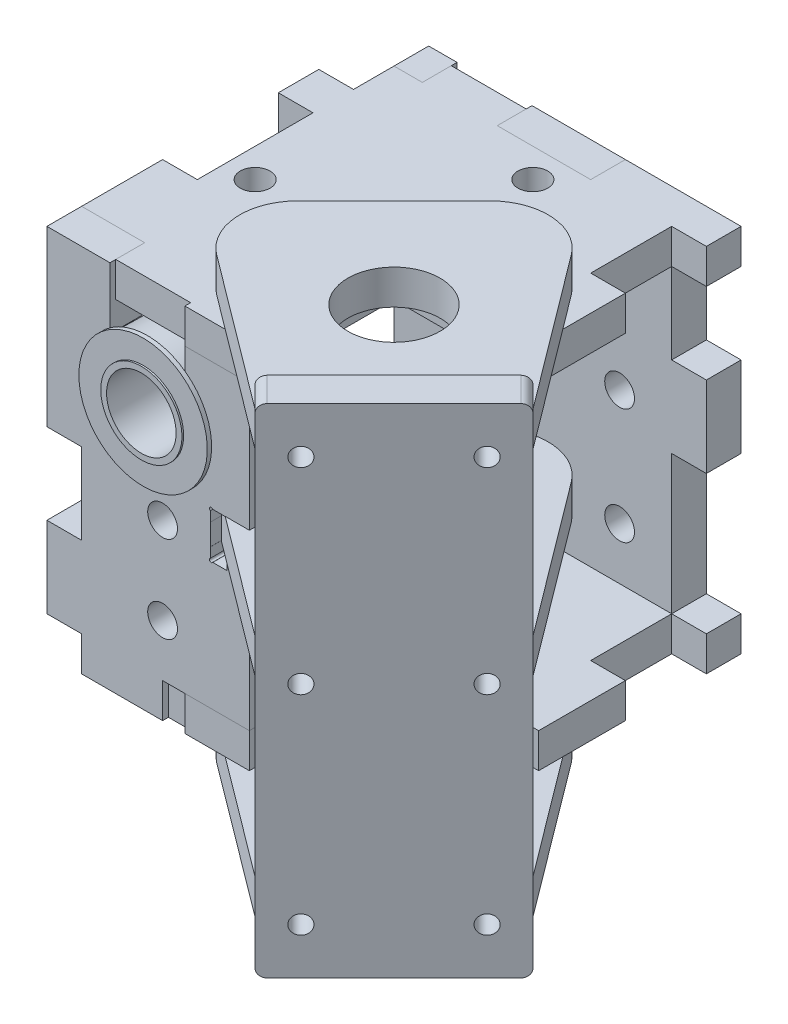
SolidWorks part; units mm, degrees
other "<linear bearing>-<Revolve1>" parameters "3mm insert"=5.15
ref_plane "Front" through (0, 0, 0) normal (0, 0, 1) x (1, 0, 0)
ref_plane "Top" through (0, 0, 0) normal (0, 1, 0) x (1, 0, 0)
ref_plane "Right" through (0, 0, 0) normal (1, 0, 0) x (0, 0, -1)
sketch "Sketch1" plane through (0, 0, 0) normal (0, 0, 1) x (1, 0, 0)
  line L0 (10.898, 53.3549) -> (10.898, 64)
  line L1 (23.852, 53.3549) -> (23.852, 64)
  line L2 (0, 64) -> (0, 0)
  line L3 (0, 0) -> (35, 0)
  line L4 (35, 64) -> (35, 0)
  line L5 (6, 99.8899) -> (6, 0) construction
  line L6 (35, 32) -> (0, 32) construction
  line L7 (10.898, 64) -> (0, 64)
  line L10 (35, 64) -> (23.852, 64)
  arc A0 (10.898, 53.3549) -> (23.852, 53.3549) centre (17.375, 45.25) ccw
  dimension "D1" = 20.75
  dimension "D5" = 35
  dimension "D7" = 1
  dimension "D2" = 12.954
  dimension "D3" = 6
  dimension "D4" = 26.5
  dimension "D6" = 64
extrude "Extrude1" add sketch "Sketch1" along normal blind 6
inserted part "linear bearing"
move or copy body "Body-Move/Copy2" placed by mates yes
sketch "Sketch2" plane through (0, 64, 0) normal (0, 1, 0) x (1, 0, 0)
  line L0 (23.852, -6) -> (35, -6)
  line L1 (0, -6) -> (10.898, -6)
  line L2 (0, -6) -> (0, 54)
  line L3 (0, 24) -> (-25.2587, 24) construction
  line L4 (35, -6) -> (35, 19)
  line L5 (0, 54) -> (10.898, 54)
  line L6 (23.852, -6) -> (23.852, -5)
  line L7 (35, 19) -> (60, 19)
  line L8 (60, 54) -> (60, 19)
  line L9 (23.852, -5) -> (10.898, -5)
  line L10 (10.898, -6) -> (10.898, -5)
  line L11 (10.898, 54) -> (10.898, 53)
  line L12 (23.852, 53) -> (10.898, 53)
  line L13 (23.852, 54) -> (23.852, 53)
  line L14 (23.852, 54) -> (60, 54)
  line L15 (35, -6) -> (0, -6) construction
  line L16 (60, 54) -> (0, 54) construction
  dimension "D1" = 60
  dimension "D2" = 1
extrude "Extrude2" add sketch "Sketch2" against normal blind 6 separate body
sketch "Sketch3" plane through (0, 0, -54) normal (0, 0, -1) x (-1, 0, 0)
  line L0 (-60, 58) -> (-60, 64) construction
  line L1 (-60, 64) -> (-35, 64)
  line L2 (-60, 64) -> (-60, 0)
  line L3 (-60, 0) -> (-35, 0)
  line L5 (0, 0) -> (0, 64)
  line L6 (0, 64) -> (-10.898, 64)
  line L7 (0, 64) -> (-10.898, 64)
  line L8 (-35, 64) -> (-35, 0)
  line L9 (-35, 0) -> (0, 0)
  line L10 (0, 0) -> (0, 64)
  line L11 (-10.898, 64) -> (-10.898, 53.3549)
  line L12 (-10.898, 64) -> (-10.898, 53.3549)
  line L14 (-35, 0) -> (0, 0)
  line L20 (-23.852, 53.3549) -> (-23.852, 64)
  line L21 (-23.852, 53.3549) -> (-23.852, 64)
  line L22 (-23.852, 64) -> (-35, 64)
  line L23 (-23.852, 64) -> (-35, 64)
  arc A1 (-23.852, 53.3549) -> (-10.898, 53.3549) centre (-17.375, 45.25) ccw
  arc A2 (-23.852, 53.3549) -> (-10.898, 53.3549) centre (-17.375, 45.25) ccw
  dimension "D1" = 0
extrude "Extrude3" add sketch "Sketch3" against normal blind 6 separate body
sketch "Sketch4" plane through (0, 0, -54) normal (0, 0, -1) x (-1, 0, 0)
  line L0 (0, 0) -> (0, 64) construction
  line L1 (-60, 0) -> (0, 0) construction
  line L2 (-60, 0) -> (-60, 30)
  line L3 (-60, 30) -> (-54, 30)
  line L4 (-54, 6) -> (-54, 30)
  line L5 (-60, 0) -> (-40, 0)
  line L6 (-60, 64) -> (-60, 0) construction
  line L7 (-54, 6) -> (-40, 6)
  line L8 (-40, 0) -> (-40, 6)
  line L9 (-13, 0) -> (-20, 0)
  line L11 (-13, 6) -> (-20, 6)
  line L12 (-20, 0) -> (-20, 6)
  line L13 (-60, 64) -> (-40, 64)
  line L14 (-60, 64) -> (-60, 44)
  line L15 (-60, 44) -> (-54, 44)
  line L16 (-54, 58) -> (-54, 44)
  line L17 (-6, 6) -> (0, 6)
  line L18 (0, 6) -> (0, 32)
  line L19 (0, 32) -> (-6, 32)
  line L20 (-6, 6) -> (-6, 32)
  line L21 (-45, 35) -> (-25, 35) construction
  line L22 (-54, 58) -> (-40, 58)
  line L23 (-40, 64) -> (-40, 58)
  line L24 (-45, 35) -> (-45, 15) construction
  line L25 (-45, 15) -> (-25, 15) construction
  line L26 (-25, 35) -> (-25, 15) construction
  line L27 (-13, 6) -> (-13, 0)
  line L28 (0, 64) -> (-6, 64)
  line L29 (0, 64) -> (0, 58)
  line L30 (0, 58) -> (-6, 58)
  line L31 (-6, 64) -> (-6, 58)
  circle A0 centre (-45, 35) radius 2.575
  circle A1 centre (-45, 15) radius 2.575
  circle A2 centre (-25, 35) radius 2.575 construction
  circle A3 centre (-25, 15) radius 2.575
  dimension "D8" = 13
  dimension "D1" = 6
  dimension "D2" = 30
  dimension "D3" = 20
  dimension "D4" = 7
  dimension "D5" = 20
  dimension "D6" = 20
  dimension "D7" = 20
  dimension "D9" = 20
  dimension "D10" = 15
  dimension "D11" = 15
extrude "Extrude4" cut sketch "Sketch4" against normal through all
sketch "Sketch6" plane through (0, 64, 0) normal (0, 1, 0) x (1, 0, 0)
  line L0 (0, 54) -> (0, -6) construction
  line L1 (0, 14) -> (6, 14)
  line L2 (0, 14) -> (0, 34)
  line L3 (0, 34) -> (6, 34)
  line L4 (6, 14) -> (6, 34)
  line L5 (35, -6) -> (23.852, -6) construction
  line L6 (23.852, 54) -> (40, 54) construction
  line L7 (35, 19) -> (60, 19) construction
  line L8 (35, -6) -> (35, 19) construction
  line L9 (60, 19) -> (60, 54) construction
  line L10 (60, 48) -> (54, 48)
  line L11 (60, 48) -> (60, 34)
  line L12 (60, 34) -> (54, 34)
  line L13 (54, 48) -> (54, 34)
  line L14 (60, 54) -> (23.852, 54) construction
  line L15 (11, 19) -> (23, 19) construction
  line L16 (35, 43) -> (35, 31) construction
  line L17 (23, 19) -> (35, 19) construction
  line L18 (35, 19) -> (35, 31) construction
  line L19 (40, 48) -> (40, 54) construction
  line L20 (0, 54) -> (6, 54)
  line L21 (0, 54) -> (0, 41)
  line L22 (0, 41) -> (6, 41)
  line L23 (6, 48) -> (6, 41)
  line L24 (23.852, 54) -> (40, 54)
  line L25 (23.852, 54) -> (23.852, 48)
  line L26 (23.852, 48) -> (40, 48)
  line L27 (40, 54) -> (40, 48)
  line L29 (6, 48) -> (10.898, 48)
  line L30 (10.898, -6) -> (0, -6)
  line L31 (6, 54) -> (10.898, 54)
  line L32 (10.898, 48) -> (10.898, 54)
  line L33 (10.898, -6) -> (10.898, 0)
  line L34 (10.898, 0) -> (0, 0)
  line L35 (0, -6) -> (0, 0)
  circle A0 centre (23, 19) radius 2.575
  circle A1 centre (11, 19) radius 2.575
  circle A2 centre (35, 31) radius 2.575
  circle A3 centre (35, 43) radius 2.575
  line B0 (45.65, 19) -> (49.35, 19)
  line B1 (45.65, 19) -> (45.65, 22.8)
  line B2 (45.65, 22.8) -> (43.53, 22.9)
  line B3 (43.53, 22.9) -> (43.53, 24.32)
  line B4 (45.65, 25.75) -> (49.35, 25.75)
  line B5 (43.53, 25.3348) -> (43.53, 24.32)
  line B6 (45.65, 25.74) -> (45.65, 25.75)
  line B7 (49.35, 25.75) -> (49.35, 25.74)
  line B8 (45.65, 25.74) -> (43.9352, 25.74)
  line B9 (49.35, 25.74) -> (51.0648, 25.74)
  line B10 (51.47, 25.3348) -> (51.47, 24.32)
  line B11 (49.35, 22.8) -> (49.35, 19)
  line B12 (51.47, 22.9) -> (51.47, 24.32)
  line B13 (49.35, 22.8) -> (51.47, 22.9)
  arc B14 (43.53, 25.3348) -> (43.9352, 25.74) centre (43.6697, 25.6003) cw
  arc B15 (51.47, 25.3348) -> (51.0648, 25.74) centre (51.3303, 25.6003) ccw
  line B16 (35, 4.65) -> (35, 8.35)
  line B17 (35, 4.65) -> (31.2, 4.65)
  line B18 (31.2, 4.65) -> (31.1, 2.53)
  line B19 (31.1, 2.53) -> (29.68, 2.53)
  line B20 (28.25, 4.65) -> (28.25, 8.35)
  line B21 (28.6652, 2.53) -> (29.68, 2.53)
  line B22 (28.26, 4.65) -> (28.25, 4.65)
  line B23 (28.25, 8.35) -> (28.26, 8.35)
  line B24 (28.26, 4.65) -> (28.26, 2.9352)
  line B25 (28.26, 8.35) -> (28.26, 10.0648)
  line B26 (28.6652, 10.47) -> (29.68, 10.47)
  line B27 (31.2, 8.35) -> (35, 8.35)
  line B28 (31.1, 10.47) -> (29.68, 10.47)
  line B29 (31.2, 8.35) -> (31.1, 10.47)
  arc B30 (28.6652, 2.53) -> (28.26, 2.9352) centre (28.3997, 2.6697) cw
  arc B31 (28.6652, 10.47) -> (28.26, 10.0648) centre (28.3997, 10.3303) ccw
  dimension "D6" = 7
  dimension "D1" = 6
  dimension "D2" = 20
  dimension "D3" = 20
  dimension "D4" = 6
  dimension "D5" = 15
  dimension "D7" = 12
  dimension "D8" = 12
sketch_block_instance "Tblock-3"
sketch_block "Tblock" parameters "D5"=0.4394, "D1"=1.7042, "D2"=3.8456, "D3"=3.8456, "D4"=2.4536, "D6"=1.5074, "D7"=1.7042, "D8"=1.5074, "D9"=7.25
sketch_block_instance "Tblock-5"
extrude "Extrude6" cut sketch "Sketch6" against normal through all
sketch "Sketch7" plane through (0, 0, 6) normal (0, 0, 1) x (1, 0, 0)
  line L0 (23.852, 64) -> (23.852, 53.3549) construction
  line L1 (35, 64) -> (23.852, 64)
  line L2 (35, 64) -> (35, 58)
  line L3 (35, 58) -> (23.852, 58)
  line L4 (23.852, 64) -> (23.852, 58)
  line L5 (35, 0) -> (35, 64) construction
  line L6 (0, 64) -> (0, 0) construction
  line L7 (0, 20) -> (6, 20)
  line L8 (0, 20) -> (0, 34)
  line L9 (0, 34) -> (6, 34)
  line L10 (6, 20) -> (6, 34)
  line L11 (10.898, 64) -> (0, 64) construction
  line L12 (0, 0) -> (35, 0) construction
  line L13 (20, 30) -> (20, 15) construction
  line L18 (35, 0) -> (20, 0)
  line L19 (35, 0) -> (35, 6)
  line L20 (35, 6) -> (20, 6)
  line L21 (20, 0) -> (20, 6)
  line L22 (6, 6) -> (0, 6)
  line L23 (6, 6) -> (6, 0)
  line L24 (6, 0) -> (0, 0)
  line L25 (0, 6) -> (0, 0)
  circle A0 centre (20, 30) radius 2.575
  circle A1 centre (20, 15) radius 2.575
  point P32 (17.5, 0)
  line B0 (35, 30.15) -> (35, 33.85)
  line B1 (35, 30.15) -> (31.2, 30.15)
  line B2 (31.2, 30.15) -> (31.1, 28.03)
  line B3 (31.1, 28.03) -> (29.68, 28.03)
  line B4 (28.25, 30.15) -> (28.25, 33.85)
  line B5 (28.6652, 28.03) -> (29.68, 28.03)
  line B6 (28.26, 30.15) -> (28.25, 30.15)
  line B7 (28.25, 33.85) -> (28.26, 33.85)
  line B8 (28.26, 30.15) -> (28.26, 28.4352)
  line B9 (28.26, 33.85) -> (28.26, 35.5648)
  line B10 (28.6652, 35.97) -> (29.68, 35.97)
  line B11 (31.2, 33.85) -> (35, 33.85)
  line B12 (31.1, 35.97) -> (29.68, 35.97)
  line B13 (31.2, 33.85) -> (31.1, 35.97)
  arc B14 (28.6652, 28.03) -> (28.26, 28.4352) centre (28.3997, 28.1697) cw
  arc B15 (28.6652, 35.97) -> (28.26, 35.5648) centre (28.3997, 35.8303) ccw
  dimension "D1" = 6
  dimension "D2" = 30
  dimension "D3" = 20
  dimension "D4" = 15
  dimension "D5" = 15
  dimension "D7" = 15
  dimension "D8" = 15
sketch_block_instance "Tblock-1"
extrude "Extrude7" cut sketch "Sketch7" against normal through all
sketch "Sketch8" plane through (0, 6, 0) normal (0, -1, 0) x (1, 0, 0)
  line L50 (35, -4.65) -> (35, 6)
  line L51 (31.2, -4.65) -> (35, -4.65)
  line L52 (31.1, -2.53) -> (31.2, -4.65)
  line L53 (28.6652, -2.53) -> (31.1, -2.53)
  line L54 (28.26, -4.65) -> (28.26, -2.9352)
  line L55 (28.25, -4.65) -> (28.26, -4.65)
  line L56 (28.25, -8.35) -> (28.25, -4.65)
  line L57 (28.26, -8.35) -> (28.25, -8.35)
  line L58 (28.26, -10.0648) -> (28.26, -8.35)
  line L59 (31.1, -10.47) -> (28.6652, -10.47)
  line L60 (31.2, -8.35) -> (31.1, -10.47)
  line L61 (35, -8.35) -> (31.2, -8.35)
  line L62 (35, -19) -> (35, -8.35)
  line L63 (45.65, -19) -> (35, -19)
  line L64 (45.65, -22.8) -> (45.65, -19)
  line L65 (43.53, -22.9) -> (45.65, -22.8)
  line L66 (43.53, -25.3348) -> (43.53, -22.9)
  line L67 (45.65, -25.74) -> (43.9352, -25.74)
  line L68 (45.65, -25.75) -> (45.65, -25.74)
  line L69 (49.35, -25.75) -> (45.65, -25.75)
  line L70 (49.35, -25.74) -> (49.35, -25.75)
  line L71 (51.0648, -25.74) -> (49.35, -25.74)
  line L72 (51.47, -22.9) -> (51.47, -25.3348)
  line L73 (49.35, -22.8) -> (51.47, -22.9)
  line L74 (49.35, -19) -> (49.35, -22.8)
  line L75 (60, -19) -> (49.35, -19)
  line L76 (60, -34) -> (60, -19)
  line L77 (54, -34) -> (60, -34)
  line L78 (54, -48) -> (54, -34)
  line L79 (60, -48) -> (54, -48)
  line L80 (60, -54) -> (60, -48)
  line L81 (40, -54) -> (60, -54)
  line L82 (40, -48) -> (40, -54)
  line L83 (23.852, -48) -> (40, -48)
  line L84 (23.852, -53) -> (23.852, -48)
  line L85 (10.898, -53) -> (23.852, -53)
  line L86 (10.898, -48) -> (10.898, -53)
  line L87 (6, -48) -> (10.898, -48)
  line L88 (6, -41) -> (6, -48)
  line L89 (0, -41) -> (6, -41)
  line L90 (0, -34) -> (0, -41)
  line L91 (6, -34) -> (0, -34)
  line L92 (6, -14) -> (6, -34)
  line L93 (0, -14) -> (6, -14)
  line L94 (0, 0) -> (0, -14)
  line L95 (10.898, 0) -> (0, 0)
  line L96 (10.898, 5) -> (10.898, 0)
  line L97 (23.852, 5) -> (10.898, 5)
  line L98 (23.852, 6) -> (23.852, 5)
  line L99 (35, 6) -> (23.852, 6)
  line L100 (35, -4.65) -> (35, 6)
  line L101 (31.2, -4.65) -> (35, -4.65)
  line L102 (31.1, -2.53) -> (31.2, -4.65)
  line L103 (28.6652, -2.53) -> (31.1, -2.53)
  line L104 (28.26, -4.65) -> (28.26, -2.9352)
  line L105 (28.25, -4.65) -> (28.26, -4.65)
  line L106 (28.25, -8.35) -> (28.25, -4.65)
  line L107 (28.26, -8.35) -> (28.25, -8.35)
  line L108 (28.26, -10.0648) -> (28.26, -8.35)
  line L109 (31.1, -10.47) -> (28.6652, -10.47)
  line L110 (31.2, -8.35) -> (31.1, -10.47)
  line L111 (35, -8.35) -> (31.2, -8.35)
  line L112 (35, -19) -> (35, -8.35)
  line L113 (45.65, -19) -> (35, -19)
  line L114 (45.65, -22.8) -> (45.65, -19)
  line L115 (43.53, -22.9) -> (45.65, -22.8)
  line L116 (43.53, -25.3348) -> (43.53, -22.9)
  line L117 (45.65, -25.74) -> (43.9352, -25.74)
  line L118 (45.65, -25.75) -> (45.65, -25.74)
  line L119 (49.35, -25.75) -> (45.65, -25.75)
  line L120 (49.35, -25.74) -> (49.35, -25.75)
  line L121 (51.0648, -25.74) -> (49.35, -25.74)
  line L122 (51.47, -22.9) -> (51.47, -25.3348)
  line L123 (49.35, -22.8) -> (51.47, -22.9)
  line L124 (49.35, -19) -> (49.35, -22.8)
  line L125 (60, -19) -> (49.35, -19)
  line L126 (60, -34) -> (60, -19)
  line L127 (54, -34) -> (60, -34)
  line L128 (54, -48) -> (54, -34)
  line L129 (60, -48) -> (54, -48)
  line L130 (60, -54) -> (60, -48)
  line L131 (40, -54) -> (60, -54)
  line L132 (40, -48) -> (40, -54)
  line L133 (23.852, -48) -> (40, -48)
  line L134 (23.852, -53) -> (23.852, -48)
  line L135 (10.898, -53) -> (23.852, -53)
  line L136 (10.898, -48) -> (10.898, -53)
  line L137 (6, -48) -> (10.898, -48)
  line L138 (6, -41) -> (6, -48)
  line L139 (0, -41) -> (6, -41)
  line L140 (0, -34) -> (0, -41)
  line L141 (6, -34) -> (0, -34)
  line L142 (6, -14) -> (6, -34)
  line L143 (0, -14) -> (6, -14)
  line L144 (0, 0) -> (0, -14)
  line L145 (10.898, 0) -> (0, 0)
  line L146 (10.898, 5) -> (10.898, 0)
  line L147 (23.852, 5) -> (10.898, 5)
  line L148 (23.852, 6) -> (23.852, 5)
  line L149 (35, 6) -> (23.852, 6)
  circle A0 centre (35, -43) radius 2.575 construction
  circle A1 centre (11, -19) radius 2.575 construction
  circle A2 centre (35, -31) radius 2.575 construction
  circle A3 centre (23, -19) radius 2.575 construction
  arc A4 (28.6652, -2.53) -> (28.26, -2.9352) centre (28.3997, -2.6697) ccw
  arc A5 (28.26, -10.0648) -> (28.6652, -10.47) centre (28.3997, -10.3303) ccw
  arc A6 (43.53, -25.3348) -> (43.9352, -25.74) centre (43.6697, -25.6003) ccw
  arc A7 (51.0648, -25.74) -> (51.47, -25.3348) centre (51.3303, -25.6003) ccw
  arc A8 (28.6652, -2.53) -> (28.26, -2.9352) centre (28.3997, -2.6697) ccw
  arc A9 (28.26, -10.0648) -> (28.6652, -10.47) centre (28.3997, -10.3303) ccw
  arc A10 (43.53, -25.3348) -> (43.9352, -25.74) centre (43.6697, -25.6003) ccw
  arc A11 (51.0648, -25.74) -> (51.47, -25.3348) centre (51.3303, -25.6003) ccw
  circle A12 centre (35, -43) radius 2.575
  circle A13 centre (11, -19) radius 2.575
  circle A14 centre (35, -31) radius 2.575
  circle A15 centre (23, -19) radius 2.575
  dimension "D1" = 0
extrude "Extrude9" add sketch "Sketch8" along normal up to surface (6 mm away) separate body
sketch "Sketch9" plane through (0, 0, 0) normal (0, -1, 0) x (1, 0, 0)
  line L0 (35, -19) -> (4.3101, -49.6899) construction
  line L1 (35, -19) -> (45.65, -19) construction
  line L2 (75.3051, -2.7365) -> (55.59, -29.0623)
  line L4 (51.2635, 21.3051) -> (24.9377, 1.59)
  line L5 (40.5146, -30.1391) -> (23.8609, -13.4854)
  line L29 (51.2635, 21.3051) -> (75.3051, -2.7365)
  arc A0 (24.9377, 1.59) -> (23.8609, -13.4854) centre (30.932, -6.4143) ccw
  arc A1 (55.59, -29.0623) -> (40.5146, -30.1391) centre (47.5857, -23.068) cw
  circle A18 centre (47.7279, -6.2721) radius 13.75
  point P13 (15.7021, -5.3265)
  point P16 (48.6735, -38.2979)
  dimension "D2" = 10
  dimension "D3" = 27.5
  dimension "D1" = 45
  dimension "D16" = 34
  dimension "D17" = 40
  dimension "D18" = 18
extrude "Extrude10" add sketch "Sketch9" along normal blind 6 separate body
sketch "Sketch10" plane through (0, 64, 0) normal (0, 1, 0) x (1, 0, 0)
  line L0 (63.2843, -9.2843) -> (24.7174, 29.2826) construction
  line L5 (40.5146, 30.1391) -> (23.8609, 13.4854)
  line L6 (40.5146, 30.1391) -> (23.8609, 13.4854)
  line L7 (75.3051, 2.7365) -> (55.59, 29.0623)
  line L8 (75.3051, 2.7365) -> (55.59, 29.0623)
  line L9 (24.9377, -1.59) -> (51.2635, -21.3051)
  line L10 (24.9377, -1.59) -> (51.2635, -21.3051)
  line L51 (51.2635, -21.3051) -> (75.3051, 2.7365)
  line L88 (51.2635, -21.3051) -> (75.3051, 2.7365)
  circle A0 centre (47.7279, 6.2721) radius 13.75 construction
  circle A1 centre (47.7279, 6.2721) radius 13.75 construction
  circle A2 centre (47.7279, 6.2721) radius 7.97
  arc A5 (55.59, 29.0623) -> (40.5146, 30.1391) centre (47.5857, 23.068) ccw
  arc A6 (55.59, 29.0623) -> (40.5146, 30.1391) centre (47.5857, 23.068) ccw
  arc A7 (23.8609, 13.4854) -> (24.9377, -1.59) centre (30.932, 6.4143) ccw
  arc A8 (23.8609, 13.4854) -> (24.9377, -1.59) centre (30.932, 6.4143) ccw
  dimension "D2" = 15.94
  dimension "D1" = 0
extrude "Extrude11" add sketch "Sketch10" along normal blind 6 separate body
ref_plane "Plane1" through (0, 36, 0) normal (0, 1, 0) x (-1, 0, 0)
sketch "Sketch12" plane through (0, 36, 0) normal (0, 1, 0) x (-1, 0, 0)
  line L3 (-63.2843, 9.2843) -> (-47.7279, -6.2721) construction
  line L13 (-75.3051, -2.7365) -> (-55.59, -29.0623)
  line L14 (-75.3051, -2.7365) -> (-55.59, -29.0623)
  line L15 (-40.5146, -30.1391) -> (-23.8609, -13.4854)
  line L16 (-40.5146, -30.1391) -> (-23.8609, -13.4854)
  line L17 (-24.9377, 1.59) -> (-51.2635, 21.3051)
  line L18 (-24.9377, 1.59) -> (-51.2635, 21.3051)
  line L59 (-51.2635, 21.3051) -> (-75.3051, -2.7365)
  line L96 (-51.2635, 21.3051) -> (-75.3051, -2.7365)
  circle A0 centre (-47.7279, -6.2721) radius 7.97 construction
  circle A1 centre (-47.7279, -6.2721) radius 7.97
  arc A9 (-55.59, -29.0623) -> (-40.5146, -30.1391) centre (-47.5857, -23.068) ccw
  arc A10 (-55.59, -29.0623) -> (-40.5146, -30.1391) centre (-47.5857, -23.068) ccw
  arc A11 (-23.8609, -13.4854) -> (-24.9377, 1.59) centre (-30.932, -6.4143) ccw
  arc A12 (-23.8609, -13.4854) -> (-24.9377, 1.59) centre (-30.932, -6.4143) ccw
  dimension "D1" = 0
extrude "Extrude13" add sketch "Sketch12" against normal blind 6 separate body
sketch "Sketch11" plane through (36.2843, 0, 36.2843) normal (0.7071, 0, 0.7071) x (0.7071, 0, -0.7071)
  line L0 (25.2015, 70) -> (28.4015, 64) construction
  line L1 (21.1838, 70) -> (55.1838, 70) construction
  line L2 (21.1838, 70) -> (21.1838, -6)
  line L3 (21.1838, -6) -> (55.1838, -6) construction
  line L4 (55.1838, 70) -> (55.1838, -6)
  line L5 (47.966, 70) -> (51.166, 64) construction
  line L6 (25.2015, 67) -> (51.166, 67) construction
  line L9 (25.2015, -3) -> (51.166, -3) construction
  line L12 (47.966, 0) -> (51.166, -6) construction
  line L13 (25.2015, 0) -> (28.4015, -6) construction
  line L16 (25.2015, 30) -> (28.4015, 36) construction
  line L17 (29.9052, 36) -> (-29.9052, 36) construction
  line L19 (47.966, 30) -> (51.166, 36) construction
  line L22 (21.1838, -6) -> (21.1838, -11)
  line L23 (21.1838, -11) -> (55.1838, -11)
  line L24 (55.1838, -11) -> (55.1838, -6)
  line L25 (21.1838, 70) -> (21.1838, 75)
  line L26 (21.1838, 75) -> (55.1838, 75)
  line L27 (55.1838, 75) -> (55.1838, 70)
  circle A0 centre (26.8015, -3) radius 1.6
  circle A1 centre (49.566, -3) radius 1.6
  circle A2 centre (49.566, 67) radius 1.6
  circle A3 centre (26.8015, 67) radius 1.6
  circle A4 centre (26.8015, 33) radius 1.6
  circle A5 centre (49.566, 33) radius 1.6
  dimension "D1" = 5
extrude "Extrude12" add sketch "Sketch11" along normal blind 6 separate body
fillet "Fillet1" radius 1.5 4 edges at (53.3848, 75, 23.4264) (77.4264, 75, -0.6152) (53.3848, -11, 23.4264) (77.4264, -11, -0.6152)
